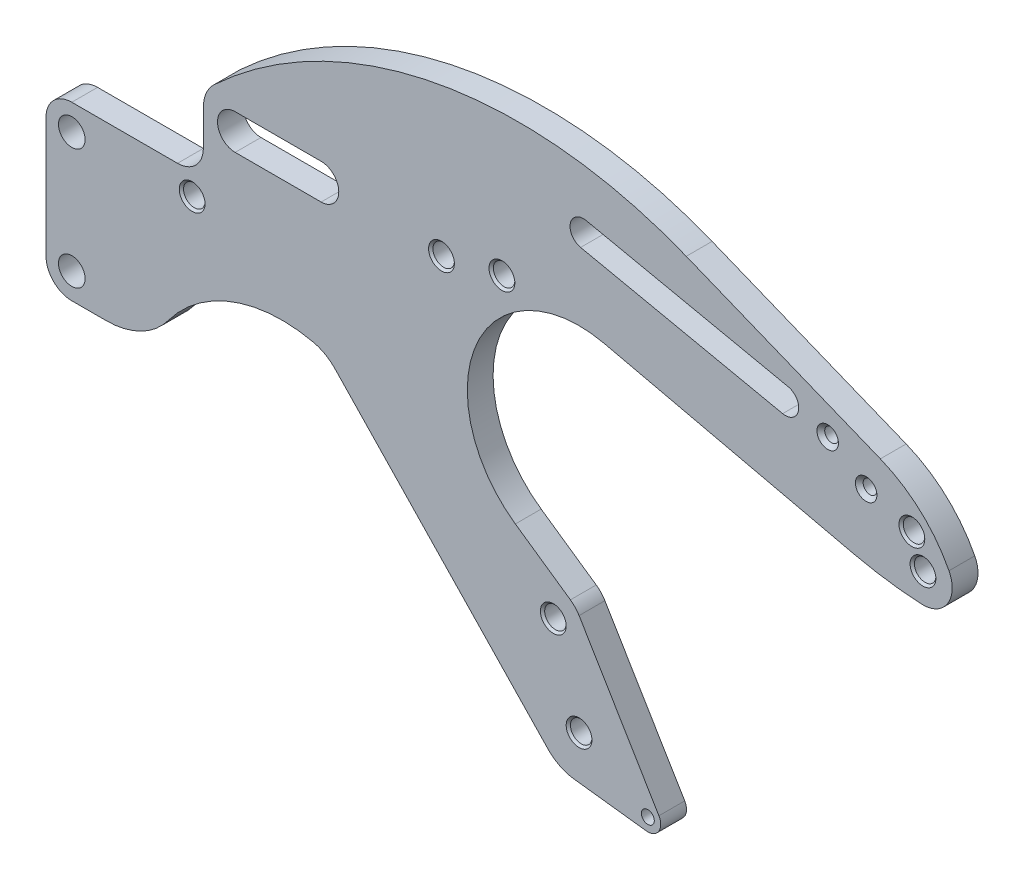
SolidWorks part; units mm, degrees
ref_plane "Face" through (0, 0, 0) normal (0, 0, 1) x (1, 0, 0)
ref_plane "Dessus" through (0, 0, 0) normal (0, 1, 0) x (1, 0, 0)
ref_plane "Droite" through (0, 0, 0) normal (1, 0, 0) x (0, 0, -1)
sketch "Esquisse1" plane through (0, 0, 0) normal (0, 0, 1) x (1, 0, 0)
  line L0 (0, -17) -> (0, -3)
  line L1 (3, 0) -> (15.3, 0)
  line L2 (18.3, 3) -> (18.3, 7.1384)
  line L3 (3, -20) -> (6.9973, -20)
  line L4 (74.4696, 20.2176) -> (97.0435, 11.1025)
  line L5 (64.9176, 6.6684) -> (93.9761, -0.024)
  line L6 (54.5905, -16.6818) -> (60.9949, -21.1241)
  line L7 (62.004, -22.2039) -> (71.2874, -37.7302)
  line L8 (61.3956, -38.9633) -> (69.8187, -39.989)
  line L9 (33.614, -11.5448) -> (58.386, -37.4552)
  arc A0 (74.4696, 20.2176) -> (19.575, 10.0666) centre (55, -28) ccw
  arc A1 (105.0235, 3.8198) -> (97.0435, 11.1025) centre (91.24, -3.27) ccw
  arc A2 (101.8164, -1.1304) -> (105.0235, 3.8198) centre (102, 2.2647) ccw
  arc A3 (93.9761, -0.024) -> (101.8164, -1.1304) centre (104.3, 44.8025) ccw
  arc A4 (64.9176, 6.6684) -> (54.5905, -16.6818) centre (62, -6) ccw
  arc A5 (62.004, -22.2039) -> (60.9949, -21.1241) centre (59, -24) ccw
  arc A6 (69.8187, -39.989) -> (71.2874, -37.7302) centre (70, -38.5) ccw
  arc A7 (58.386, -37.4552) -> (61.3956, -38.9633) centre (62, -34) ccw
  arc A8 (33.614, -11.5448) -> (31.1043, -10.1235) centre (30, -15) ccw
  arc A9 (31.1043, -10.1235) -> (14.2194, -16.3703) centre (27.46, -26.216) ccw
  arc A10 (14.2194, -16.3703) -> (6.9973, -20) centre (6.9973, -11) cw
  arc A11 (0, -17) -> (3, -20) centre (3, -17) ccw
  arc A12 (0, -3) -> (3, 0) centre (3, -3) cw
  arc A13 (15.3, 0) -> (18.3, 3) centre (15.3, 3) ccw
  arc A14 (18.3, 7.1384) -> (19.575, 10.0666) centre (22.3, 7.1384) cw
  point P38 (0, 0)
  dimension "D1" = 104
  dimension "D8" = 31
  dimension "D10" = 6.8
  dimension "D12" = 92
  dimension "D15" = 26
  dimension "D18" = 7
  dimension "D19" = 3
  dimension "D22" = 10
  dimension "D25" = 10
  dimension "D28" = 33
  dimension "D30" = 9
  dimension "D31" = 3
  dimension "D32" = 4
  dimension "D2" = 55
  dimension "D3" = 18.3
  dimension "D4" = 20
  dimension "D5" = 28
  dimension "D6" = 91.24
  dimension "D7" = 3.27
  dimension "D9" = 102
  dimension "D11" = 104.3
  dimension "D13" = 62
  dimension "D14" = 6
  dimension "D16" = 59
  dimension "D17" = 24
  dimension "D20" = 38.5
  dimension "D21" = 70
  dimension "D23" = 62
  dimension "D24" = 34
  dimension "D26" = 30
  dimension "D27" = 15
  dimension "D29" = 27.46
extrude "Extrusion1" add sketch "Esquisse1" along normal blind 3
sketch "Esquisse2" plane through (0, 0, 3) normal (0, 0, 1) x (1, 0, 0)
  line L0 (15.3, 0) -> (3, 0) construction
  line L1 (0, -3) -> (0, -17) construction
  line L2 (22, 8.55) -> (32, 8.55)
  line L3 (22, 4.45) -> (32, 4.45)
  arc A0 (22, 8.55) -> (22, 4.45) centre (22, 6.5) ccw
  arc A1 (32, 4.45) -> (32, 8.55) centre (32, 6.5) ccw
  dimension "D1" = 4.1
  dimension "D2" = 4.1
  dimension "D3" = 6.5
  dimension "D4" = 22
  dimension "D5" = 10
extrude "Enlèv. mat.-Extru.1" cut sketch "Esquisse2" against normal blind 3
sketch "Esquisse3" plane through (0, 0, 3) normal (0, 0, 1) x (1, 0, 0)
  line L1 (15.3, 0) -> (3, 0) construction
  line L2 (0, -3) -> (0, -17) construction
  line L3 (62.8219, 17.9962) -> (86.3219, 13.0062)
  line L4 (62.1781, 14.9638) -> (85.6781, 9.9738)
  arc A0 (62.8219, 17.9962) -> (62.1781, 14.9638) centre (62.5, 16.48) ccw
  arc A2 (85.6781, 9.9738) -> (86.3219, 13.0062) centre (86, 11.49) ccw
  dimension "D1" = 3.1
  dimension "D2" = 16.48
  dimension "D6" = 3.1
  dimension "D3" = 62.5
  dimension "D4" = 11.49
  dimension "D5" = 86
extrude "Enlèv. mat.-Extru.2" cut sketch "Esquisse3" against normal blind 3
sketch "Esquisse4" plane through (0, 0, 3) normal (0, 0, 1) x (1, 0, 0)
  line L0 (0, -3) -> (0, -17) construction
  line L1 (15.3, 0) -> (3, 0) construction
  circle A0 centre (3, -3) radius 1.55
  circle A1 centre (3, -17) radius 1.55
  dimension "D1" = 3.1
  dimension "D2" = 3.1
  dimension "D3" = 3
  dimension "D4" = 3
  dimension "D5" = 3
  dimension "D6" = 14
extrude "Enlèv. mat.-Extru.3" cut sketch "Esquisse4" against normal through all
hole_wizard "Trou taraudé M3x0.51" positions "Esquisse3D1" profile "Esquisse5" tap size "M3x0.5" standard "ISO"
sketch3d "Esquisse3D1"
  line L0 (15.3, 0, 3) -> (3, 0, 3) construction
  line L1 (0, -3, 3) -> (0, -17, 3) construction
  point P0 (17, -2.5, 3)
  point P5 (61.9849, -33.9724, 1.6306)
  dimension "D1" = 2.5
  dimension "D2" = 17
  dimension "D3" = 34
  dimension "D4" = 62
sketch "Esquisse5" plane through (17, -2.5, 3) normal (1, 0, 0) x (0, -1, 0)
  line L0 (0, 0) -> (0, 3)
  line L1 (0, 3) -> (1.5, 3)
  line L2 (1.25, 2.75) -> (1.25, 0.25)
  line L3 (1.25, 0.25) -> (1.5, 0)
  line L5 (1.5, 0) -> (0, 0)
  line L6 (-1.25, 0.25) -> (-1.5, 0) construction
  line L7 (1.5, 3) -> (1.25, 2.75)
  line L8 (-1.5, 3) -> (-1.25, 2.75) construction
  line L11 (0, -6.35) -> (0, 107.95) construction
  dimension "Diamètre du trou pour taraudage jusqu'au prochain" = 2.5
  dimension "Profondeur du trou pour taraudage jusqu'au prochain" = 3
  dimension "Diamètre du fraisage entrant" = 3
  dimension "Angle du fraisage entrant" = 90
  dimension "Diamètre du fraisage débouchant" = 3
  dimension "Angle du fraisage débouchant" = 90
hole_wizard "Trou taraudé M3x0.52" positions "Esquisse3D2" profile "Esquisse6" tap size "M3x0.5" standard "ISO"
sketch3d "Esquisse3D2"
  line L1 (62, -34, 3) -> (62, -34, 0) construction
  line L2 (15.3, 0, 3) -> (3, 0, 3) construction
  line L3 (0, -3, 3) -> (0, -17, 3) construction
  point P0 (53.03, 7.56, 3)
  point P1 (59, -24, 3)
  point P2 (46, 6, 3)
  point P3 (62, -34, 3)
  point P6 (100.71, 5.6, 3)
  point P7 (102, 2.26, 3)
  dimension "D1" = 6
  dimension "D2" = 7.56
  dimension "D3" = 2.26
  dimension "D4" = 5.6
  dimension "D5" = 24
  dimension "D6" = 34
  dimension "D7" = 59
  dimension "D8" = 46
  dimension "D9" = 53.03
  dimension "D10" = 100.71
  dimension "D11" = 102
sketch "Esquisse6" plane through (53.03, 7.56, 3) normal (1, 0, 0) x (0, -1, 0)
  line L0 (0, 0) -> (0, 3)
  line L1 (0, 3) -> (1.5, 3)
  line L2 (1.25, 2.75) -> (1.25, 0.25)
  line L3 (1.25, 0.25) -> (1.5, 0)
  line L5 (1.5, 0) -> (0, 0)
  line L6 (-1.25, 0.25) -> (-1.5, 0) construction
  line L7 (1.5, 3) -> (1.25, 2.75)
  line L8 (-1.5, 3) -> (-1.25, 2.75) construction
  line L11 (0, -6.35) -> (0, 107.95) construction
  dimension "Diamètre du trou pour taraudage jusqu'au prochain" = 2.5
  dimension "Profondeur du trou pour taraudage jusqu'au prochain" = 3
  dimension "Diamètre du fraisage entrant" = 3
  dimension "Angle du fraisage entrant" = 90
  dimension "Diamètre du fraisage débouchant" = 3
  dimension "Angle du fraisage débouchant" = 90
hole_wizard "Trou taraudé M3x0.53" positions "Esquisse3D3" profile "Esquisse7" tap size "M3x0.5" standard "ISO"
sketch3d "Esquisse3D3"
  line L0 (15.3, 0, 3) -> (3, 0, 3) construction
  line L1 (0, -3, 3) -> (0, -17, 3) construction
  point P0 (62, -34, 3)
  dimension "D1" = 34
  dimension "D2" = 62
sketch "Esquisse7" plane through (62, -34, 3) normal (1, 0, 0) x (0, -1, 0)
  line L0 (0, 0) -> (0, 3)
  line L1 (0, 3) -> (1.5, 3)
  line L2 (1.25, 2.75) -> (1.25, 0.25)
  line L3 (1.25, 0.25) -> (1.5, 0)
  line L5 (1.5, 0) -> (0, 0)
  line L6 (-1.25, 0.25) -> (-1.5, 0) construction
  line L7 (1.5, 3) -> (1.25, 2.75)
  line L8 (-1.5, 3) -> (-1.25, 2.75) construction
  line L11 (0, -6.35) -> (0, 107.95) construction
  dimension "Diamètre du trou pour taraudage jusqu'au prochain" = 2.5
  dimension "Profondeur du trou pour taraudage jusqu'au prochain" = 3
  dimension "Diamètre du fraisage entrant" = 3
  dimension "Angle du fraisage entrant" = 90
  dimension "Diamètre du fraisage débouchant" = 3
  dimension "Angle du fraisage débouchant" = 90
hole_wizard "Trou taraudé M2x0.42" positions "Esquisse3D5" profile "Esquisse9" tap size "M2x0.4" standard "ISO"
sketch3d "Esquisse3D5"
  line L0 (0, -3, 3) -> (0, -17, 3) construction
  line L1 (15.3, 0, 3) -> (3, 0, 3) construction
  point P0 (90.92, 10.24, 3)
  point P1 (95.39, 7.24, 3)
  dimension "D1" = 95.39
  dimension "D2" = 90.92
  dimension "D3" = 7.24
  dimension "D4" = 10.24
sketch "Esquisse9" plane through (90.92, 10.24, 3) normal (1, 0, 0) x (0, -1, 0)
  line L0 (0, 0) -> (0, 3)
  line L1 (0, 3) -> (1.25, 3)
  line L2 (0.8, 2.55) -> (0.8, 0.45)
  line L3 (0.8, 0.45) -> (1.25, 0)
  line L5 (1.25, 0) -> (0, 0)
  line L6 (-0.8, 0.45) -> (-1.25, 0) construction
  line L7 (1.25, 3) -> (0.8, 2.55)
  line L8 (-1.25, 3) -> (-0.8, 2.55) construction
  line L11 (0, -6.35) -> (0, 107.95) construction
  dimension "Diamètre du trou pour taraudage jusqu'au prochain" = 1.6
  dimension "Profondeur du trou pour taraudage jusqu'au prochain" = 3
  dimension "Diamètre du fraisage entrant" = 2.5
  dimension "Angle du fraisage entrant" = 90
  dimension "Diamètre du fraisage débouchant" = 2.5
  dimension "Angle du fraisage débouchant" = 90
sketch "Esquisse10" plane through (0, 0, 3) normal (0, 0, 1) x (1, 0, 0)
  line L0 (15.3, 0) -> (3, 0) construction
  line L1 (0, -3) -> (0, -17) construction
  circle A0 centre (70, -38.5) radius 0.75
  dimension "D3" = 1.5
  dimension "D1" = 38.5
  dimension "D2" = 70
extrude "Enlèv. mat.-Extru.4" cut sketch "Esquisse10" against normal blind 10
